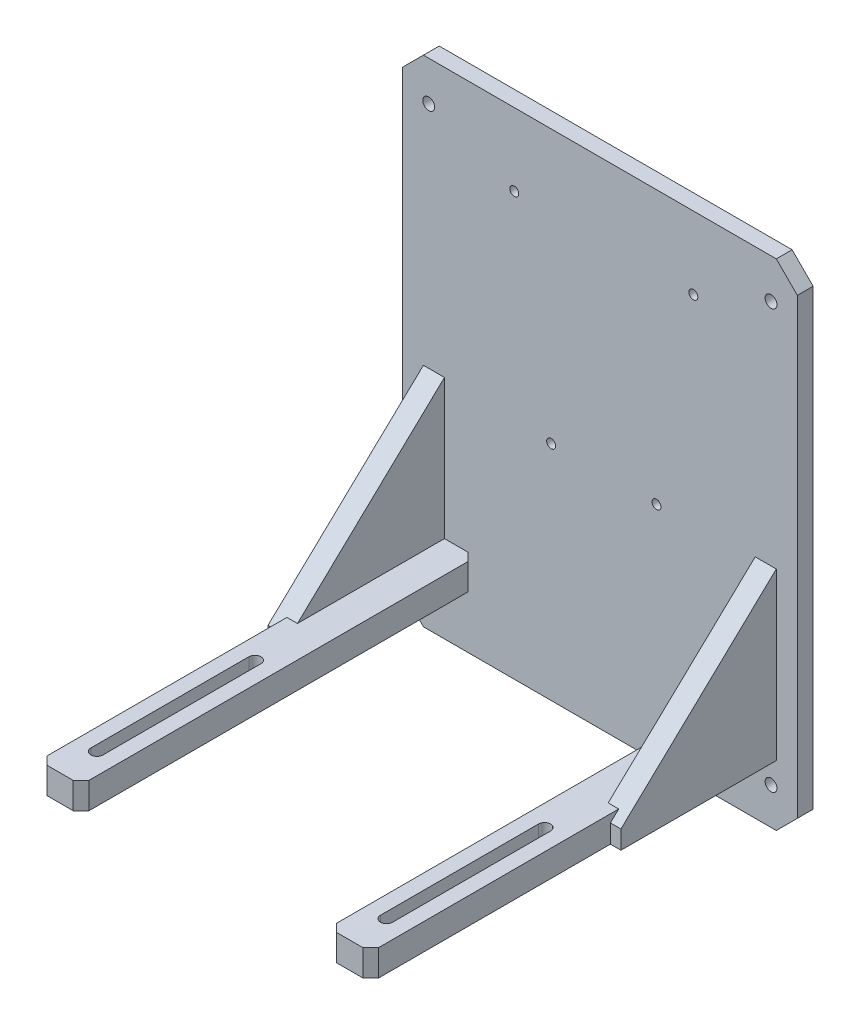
SolidWorks part; units mm, degrees
ref_plane "前视基准面" through (0, 0, 0) normal (0, 0, 1) x (1, 0, 0)
ref_plane "上视基准面" through (0, 0, 0) normal (0, 1, 0) x (1, 0, 0)
ref_plane "右视基准面" through (0, 0, 0) normal (1, 0, 0) x (0, 0, -1)
other "Configuration Table"
sketch "草图1" plane through (0, 0, 0) normal (0, 0, 1) x (1, 0, 0)
  line L0 (-67, -128) -> (67, -128)
  line L1 (67, -128) -> (75, -120)
  line L2 (75, -120) -> (75, 52)
  line L3 (75, 52) -> (67, 60)
  line L4 (67, 60) -> (-67, 60)
  line L5 (-67, 60) -> (-75, 52)
  line L6 (-75, 52) -> (-75, -120)
  line L7 (-75, -120) -> (-67, -128)
  circle A0 centre (-32.5, 32.5) radius 1.7
  circle A1 centre (35.5, 32.5) radius 1.7
  circle A2 centre (-18.5, -43.5) radius 1.7
  circle A3 centre (21.5, -43.5) radius 1.7
  circle A4 centre (-65, -114) radius 2.25
  circle A5 centre (65, -114) radius 2.25
  circle A6 centre (-65, 45) radius 2.25
  circle A7 centre (65, 45) radius 2.25
  dimension "D1" = 4.5
  dimension "D2" = 3.4
  dimension "D3" = 21.5
  dimension "D4" = 35.5
  dimension "D5" = 65
  dimension "D6" = 67
  dimension "D7" = 75
  dimension "D8" = 18.5
  dimension "D9" = 32.5
  dimension "D10" = 65
  dimension "D11" = 67
  dimension "D12" = 32.5
  dimension "D13" = 45
  dimension "D14" = 52
  dimension "D15" = 60
  dimension "D16" = 43.5
  dimension "D17" = 114
  dimension "D18" = 120
extrude "Base_150x188x6" add sketch "草图1" along normal blind 6
sketch "草图2" plane through (0, 0, 0) normal (0, 1, 0) x (1, 0, 0)
  line L0 (-60, -6) -> (-50, -6)
  line L1 (-50, -6) -> (-47, -9)
  line L2 (-47, -9) -> (-47, -153)
  line L3 (-47, -153) -> (-50, -156)
  line L4 (-50, -156) -> (-60, -156)
  line L5 (-60, -156) -> (-63, -153)
  line L6 (-63, -153) -> (-63, -9)
  line L7 (-63, -9) -> (-60, -6)
  line L8 (-57.3, -82) -> (-57.3, -142)
  line L9 (-52.7, -142) -> (-52.7, -82)
  line L10 (50, -6) -> (60, -6)
  line L11 (60, -6) -> (63, -9)
  line L12 (63, -9) -> (63, -153)
  line L13 (63, -153) -> (60, -156)
  line L14 (60, -156) -> (50, -156)
  line L15 (50, -156) -> (47, -153)
  line L16 (47, -153) -> (47, -9)
  line L17 (47, -9) -> (50, -6)
  line L18 (52.7, -82) -> (52.7, -142)
  line L19 (57.3, -142) -> (57.3, -82)
  arc A0 (-57.3, -142) -> (-52.7, -142) centre (-55, -142) ccw
  arc A1 (-52.7, -82) -> (-57.3, -82) centre (-55, -82) ccw
  arc A2 (52.7, -142) -> (57.3, -142) centre (55, -142) ccw
  arc A3 (57.3, -82) -> (52.7, -82) centre (55, -82) ccw
  dimension "D1" = 2.3
  dimension "D2" = 47
  dimension "D3" = 50
  dimension "D4" = 55
  dimension "D5" = 60
  dimension "D6" = 47
  dimension "D7" = 55
  dimension "D8" = 6
  dimension "D9" = 9
  dimension "D10" = 82
  dimension "D11" = 142
  dimension "D12" = 153
extrude "Side_rails_open94_M4_travel60" add sketch "草图2" along normal blind 10 from offset 105
sketch "草图3" plane through (0, 0, 0) normal (1, 0, 0) x (0, 0, -1)
  line L0 (-6, -105) -> (-6, -42)
  line L1 (-6, -42) -> (-65, -98)
  line L2 (-65, -98) -> (-65, -105)
  line L3 (-65, -105) -> (-6, -105)
  dimension "D1" = 6
  dimension "D2" = 65
  dimension "D3" = 42
  dimension "D4" = 98
  dimension "D5" = 105
extrude "Left_gusset" add sketch "草图3" along normal blind 8 from offset 67
sketch "草图4" plane through (0, 0, 0) normal (1, 0, 0) x (0, 0, -1)
  line L0 (-6, -105) -> (-6, -42)
  line L1 (-6, -42) -> (-65, -98)
  line L2 (-65, -98) -> (-65, -105)
  line L3 (-65, -105) -> (-6, -105)
  dimension "D1" = 6
  dimension "D2" = 65
  dimension "D3" = 42
  dimension "D4" = 98
  dimension "D5" = 105
extrude "Right_gusset" add sketch "草图4" along normal blind 8 from offset 59
